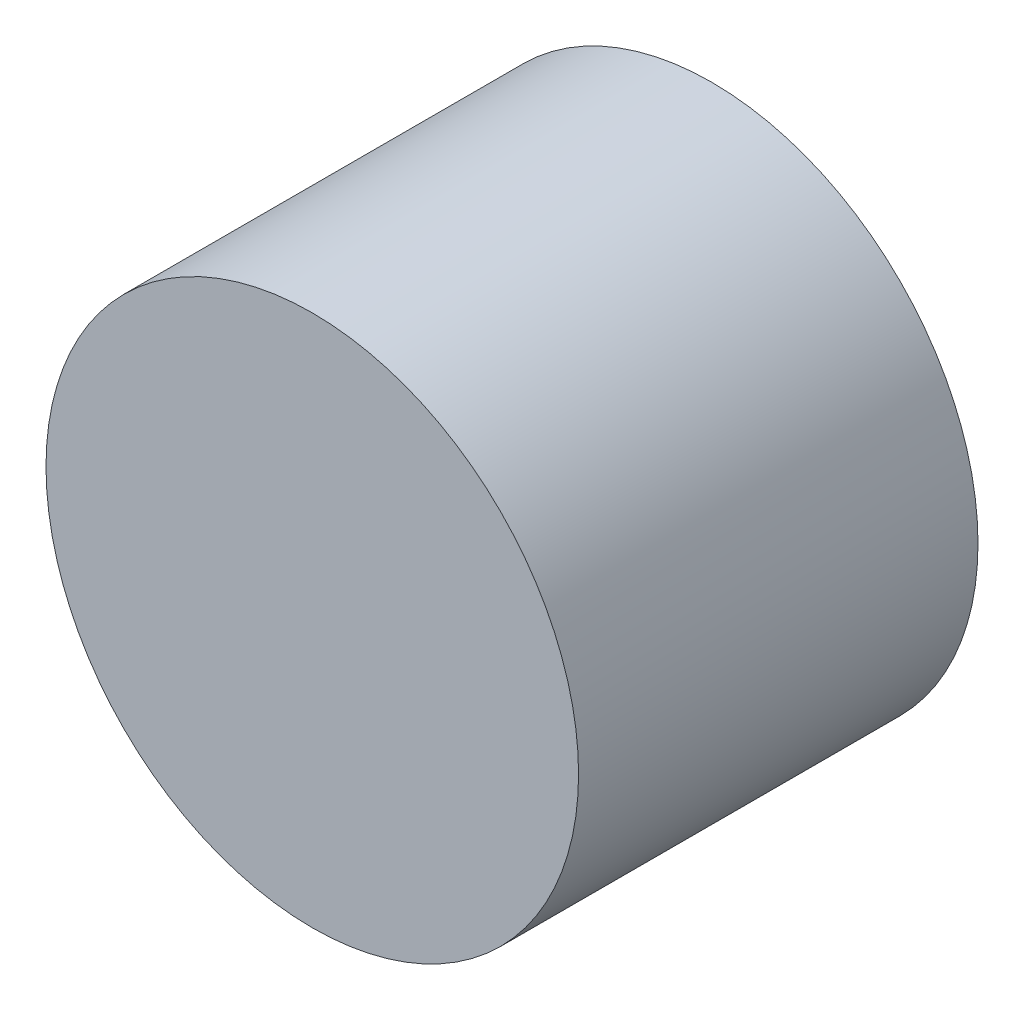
SolidWorks part; units mm, degrees
ref_plane "Front" through (0, 0, 0) normal (0, 0, 1) x (1, 0, 0)
ref_plane "Top" through (0, 0, 0) normal (0, 1, 0) x (1, 0, 0)
ref_plane "Right" through (0, 0, 0) normal (1, 0, 0) x (0, 0, -1)
sketch "Sketch1" plane through (0, 0, 0) normal (0, 0, 1) x (1, 0, 0)
  arc A0 (100, 0) -> (-100, 0) centre (0, 0) ccw
  arc A1 (100, 0) -> (-100, 0) centre (0, 0) cw
  dimension "D1" = 100
extrude "Extrude1" add sketch "Sketch1" along normal mid plane 150
ref_plane "Plane1" through (0, 200, 0) normal (0, 1, 0) x (-1, 0, 0)
sketch "Sketch2" plane through (0, 200, 0) normal (0, 1, 0) x (-1, 0, 0)
  circle A0 centre (0, 0) radius 99.4868
